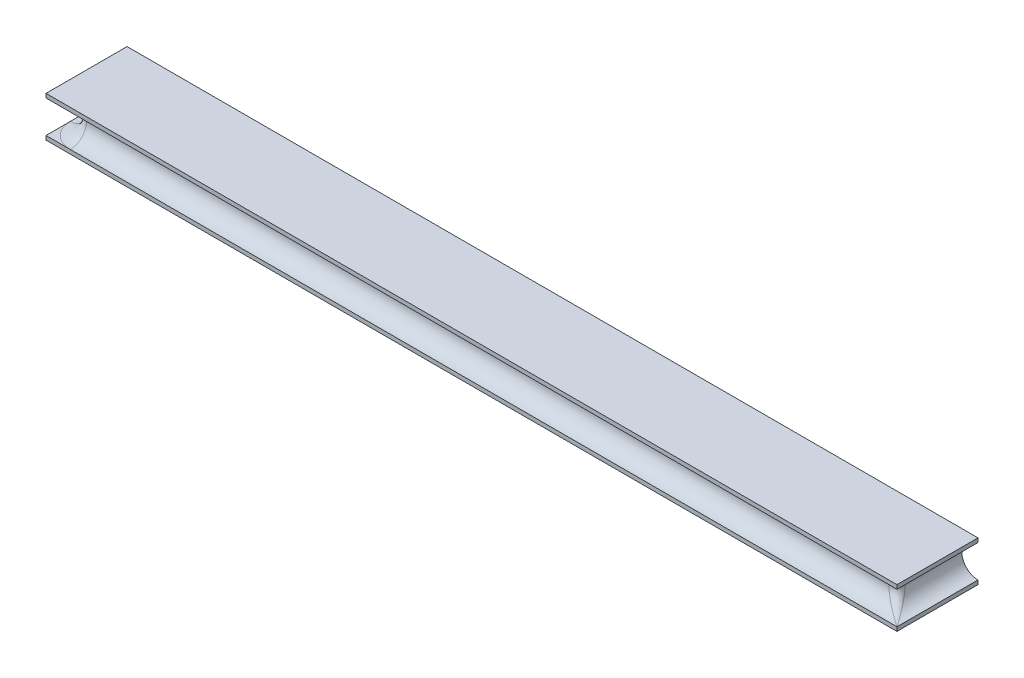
SolidWorks part; units mm, degrees
ref_plane "Vorne" through (0, 0, 0) normal (0, 0, 1) x (1, 0, 0)
ref_plane "Oben" through (0, 0, 0) normal (0, 1, 0) x (1, 0, 0)
ref_plane "Rechts" through (0, 0, 0) normal (1, 0, 0) x (0, 0, -1)
sketch "Skizze1" plane through (0, 0, 0) normal (0, 1, 0) x (1, 0, 0)
  line L0 (0, 5) -> (0, -5) construction
  line L1 (-52.5, 5) -> (52.5, 5)
  line L2 (-52.5, 5) -> (-52.5, -5)
  line L3 (-52.5, -5) -> (52.5, -5)
  line L4 (52.5, 5) -> (52.5, -5)
  dimension "D1" = 10
  dimension "D2" = 105
extrude "Linear austragen1" add sketch "Skizze1" along normal mid plane 5
sketch "Skizze2" plane through (0, 0, 0) normal (0, 1, 0) x (1, 0, 0)
  line L0 (-52.5, 5) -> (-52.5, -2)
  line L1 (-49.5, -5) -> (52.5, -5)
  line L2 (-52.5, -5) -> (52.5, -5) construction
  arc A0 (-52.5, -2) -> (-49.5, -5) centre (-49.5, -2) ccw
  dimension "D1" = 3
ref_plane "Ebene1" through (-52.5, 0, -5) normal (0, 0, 1) x (1, 0, 0)
sketch "Skizze3" plane through (-52.5, 0, -5) normal (0, 0, 1) x (1, 0, 0)
  line L0 (0, 2.5) -> (0, -2.5) construction
  line L1 (0, 2) -> (-10, 2)
  line L2 (-10, 2) -> (-10, -2)
  line L3 (-10, -2) -> (0, -2)
  arc A0 (0, -2) -> (0, 2) centre (0, 0) ccw
  dimension "D1" = 4
  dimension "D2" = 10
sweep "Schnitt-Austragung1" cut profiles "Skizze3" path "Skizze2"
sketch "Skizze4" plane through (0, 0, -5) normal (0, 0, -1) x (-1, 0, 0)
  line L0 (-52.5, 2.5) -> (-52.5, -2.5) construction
  circle A0 centre (-52.5, 0) radius 2
  arc A1 (52.5, 2) -> (52.5, -2) centre (52.5, 0) ccw construction
extrude "Schnitt-Linear austragen1" cut sketch "Skizze4" against normal through all
fillet "Verrundung1" radius 1 1 edges at (50.5, 0, 3)
